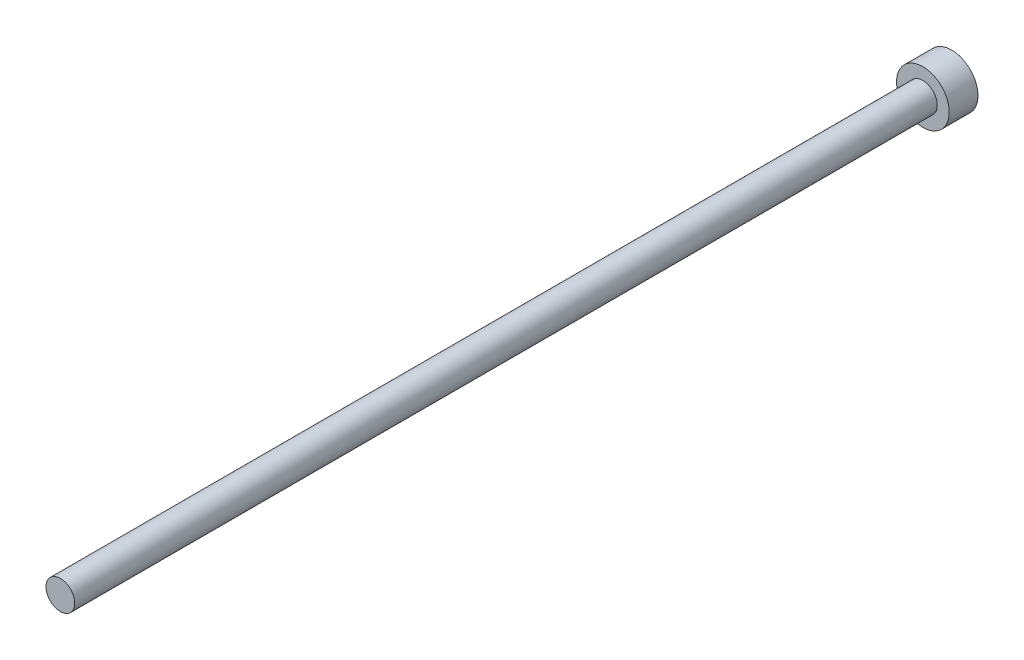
SolidWorks part; units mm, degrees
ref_plane "前视基准面" through (0, 0, 0) normal (0, 0, 1) x (1, 0, 0)
ref_plane "上视基准面" through (0, 0, 0) normal (0, 1, 0) x (1, 0, 0)
ref_plane "右视基准面" through (0, 0, 0) normal (1, 0, 0) x (0, 0, -1)
other "Configuration Table"
sketch "草图1" plane through (0, 0, 0) normal (0, 0, 1) x (1, 0, 0)
  circle A0 centre (0, 0) radius 2.75
  dimension "D1" = 5.5
extrude "Head_envelope" add sketch "草图1" along normal blind 3 from offset 3
sketch "草图2" plane through (0, 0, 0) normal (0, 0, 1) x (1, 0, 0)
  circle A0 centre (0, 0) radius 1.5
  dimension "D1" = 3
extrude "Shank_envelope_no_threads" add sketch "草图2" along normal blind 90
